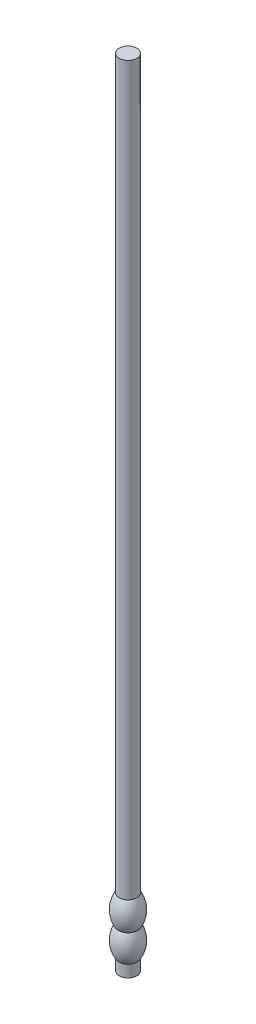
SolidWorks part; units mm, degrees
ref_plane "Ebene vorne" through (0, 0, 0) normal (0, 0, 1) x (1, 0, 0)
ref_plane "Ebene oben" through (0, 0, 0) normal (0, 1, 0) x (1, 0, 0)
ref_plane "Ebene rechts" through (0, 0, 0) normal (1, 0, 0) x (0, 0, -1)
sketch "Skizze1" plane through (0, 0, 0) normal (0, 0, 1) x (1, 0, 0)
  line L0 (0, -15.8454) -> (0, 93.5868) construction
  line L1 (0, 0) -> (10, 0)
  line L2 (10, 0) -> (10, 13.4169)
  line L3 (10, 76.5831) -> (10, 900)
  line L4 (10, 900) -> (0, 900)
  line L5 (0, 900) -> (0, 0)
  line L6 (-835, 900) -> (-1165, 900) construction
  arc A0 (10, 13.4169) -> (10.9808, 45) centre (-15, 30) ccw
  arc A1 (10.9808, 45) -> (10, 76.5831) centre (-15, 60) ccw
  dimension "D1" = 30
  dimension "D2" = 30
  dimension "D5" = 30
  dimension "D6" = 30
  dimension "D7" = 30
  dimension "D3" = 30
  dimension "D4" = 20
  dimension "D8" = 20
revolve "Rotation1" add sketch "Skizze1" angle 360 about L0
